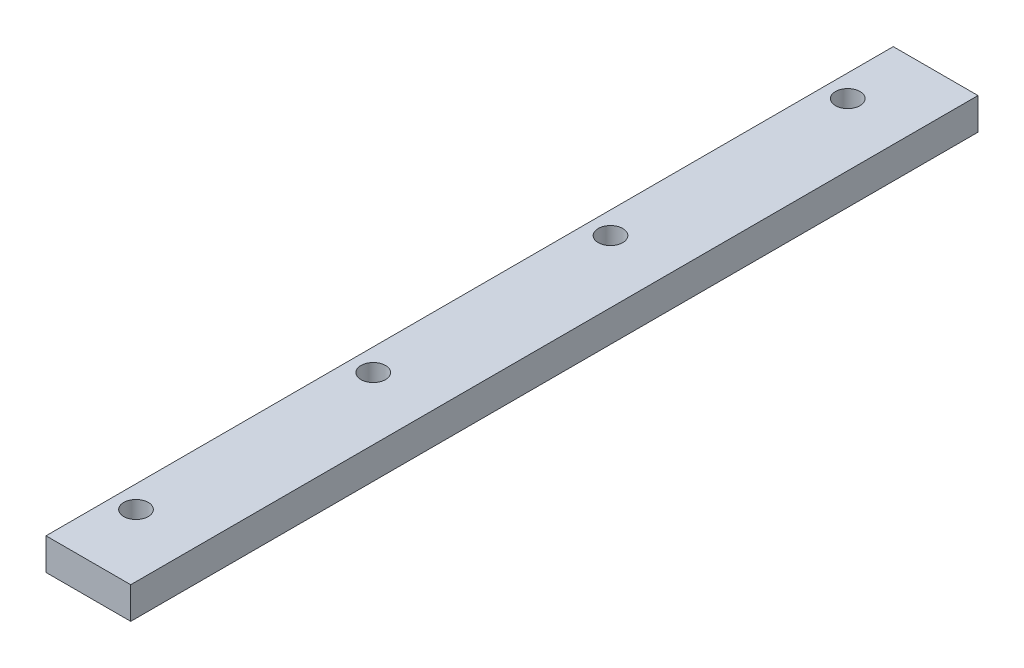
SolidWorks part; units mm, degrees
ref_plane "Front" through (0, 0, 0) normal (0, 0, 1) x (1, 0, 0)
ref_plane "Top" through (0, 0, 0) normal (0, 1, 0) x (1, 0, 0)
ref_plane "Right" through (0, 0, 0) normal (1, 0, 0) x (0, 0, -1)
sketch "Sketch1" plane through (0, 0, 0) normal (0, 0, 1) x (1, 0, 0)
  line L0 (-5.317, -31.1074) -> (-5.317, -21.557) construction
  line L2 (4.843, 0) -> (4.843, 3.81)
  line L3 (4.843, 3.81) -> (-5.317, 3.81)
  line L4 (-5.317, 3.81) -> (-5.317, 0)
  line L5 (-5.317, 0) -> (4.843, 0)
  dimension "D3" = 3.81
  dimension "D4" = 10.16
extrude "Extrude1" add sketch "Sketch1" along normal blind 101.6
hole_wizard "#32 (0.116) Diameter Hole1" positions "Sketch3" profile "Sketch2" hole size "#32" standard "Ansi Inch"
sketch "Sketch3" plane through (0, 3.81, 0) normal (0, 1, 0) x (-1, 0, 0)
  circle A0 centre (2.65, 8.128) radius 1.1303 construction
  circle A1 centre (2.65, 36.576) radius 1.1303 construction
  circle A2 centre (2.65, 65.024) radius 1.1303 construction
  circle A3 centre (2.65, 93.472) radius 1.1303 construction
  point P0 (2.65, 8.128)
  point P1 (2.65, 36.576)
  point P2 (2.65, 65.024)
  point P3 (2.65, 93.472)
sketch "Sketch2" plane through (-2.65, 3.81, 8.128) normal (1, 0, 0) x (0, 0, 1)
  line L0 (0, 0) -> (0, 3.81)
  line L1 (0, 3.81) -> (1.4732, 3.81)
  line L2 (1.4732, 3.81) -> (1.4732, 0)
  line L5 (1.4732, 0) -> (0, 0)
  line L11 (0, -6.35) -> (0, 107.95) construction
  dimension "Thru Hole Dia." = 2.9464
  dimension "Thru Hole Depth" = 3.81
